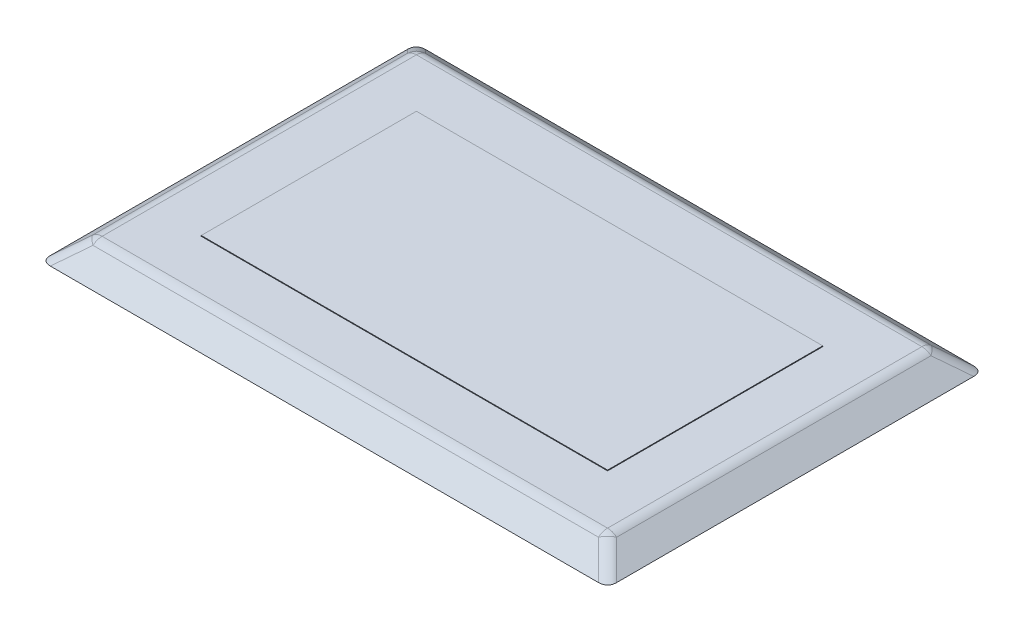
SolidWorks part; units mm, degrees
ref_plane "Front Plane" through (0, 0, 0) normal (0, 0, 1) x (1, 0, 0)
ref_plane "Top Plane" through (0, 0, 0) normal (0, 1, 0) x (1, 0, 0)
ref_plane "Right Plane" through (0, 0, 0) normal (1, 0, 0) x (0, 0, -1)
sketch "Sketch1" plane through (0, 0, 0) normal (0, 1, 0) x (1, 0, 0)
  line L1 (-40, 26.5) -> (40, 26.5)
  line L2 (-40, 26.5) -> (-40, -26.5)
  line L3 (-40, -26.5) -> (40, -26.5)
  line L4 (40, 26.5) -> (40, -26.5)
  line L5 (-40, 26.5) -> (40, -26.5) construction
  line L6 (-40, -26.5) -> (40, 26.5) construction
  point P0 (0, 0)
  dimension "D1" = 80
  dimension "D2" = 53
extrude "Boss-Extrude1" add sketch "Sketch1" along normal blind 3
chamfer "Chamfer1" distance 3 angle 50 4 edges at (-40, 3, 0) (0, 3, -26.5) (40, 3, 0) (0, 3, 26.5)
fillet "Fillet1" radius 2 8 edges at (0, 3, 22.9247) (36.4247, 3, 0) (0, 3, -22.9247) (-36.4247, 3, 0) (-38.2124, 1.5, -24.7124) (-38.2124, 1.5, 24.7124) (38.2124, 1.5, -24.7124) (38.2124, 1.5, 24.7124)
sketch "Sketch2" plane through (0, 3, 0) normal (0, 1, 0) x (1, 0, 0)
  line L0 (35.6968, -22.1968) -> (35.6968, 22.1968) construction
  line L1 (-28.6968, 15.1968) -> (28.6968, 15.1968)
  line L2 (-28.6968, 15.1968) -> (-28.6968, -15.1968)
  line L3 (-28.6968, -15.1968) -> (28.6968, -15.1968)
  line L4 (28.6968, 15.1968) -> (28.6968, -15.1968)
  line L5 (-28.6968, 15.1968) -> (28.6968, -15.1968) construction
  line L6 (-28.6968, -15.1968) -> (28.6968, 15.1968) construction
  line L7 (-35.6968, -22.1968) -> (35.6968, -22.1968) construction
  point P0 (0, 0)
  point P6 (35.6968, 0)
  dimension "D1" = 7
  dimension "D2" = 7
extrude "Boss-Extrude2" add sketch "Sketch2" along normal blind 0.1
sketch "Sketch3" plane through (0, 3.1, 0) normal (0, 1, 0) x (1, 0, 0)
  line L0 (-21.997, -5.1235) -> (21.997, -5.1235)
  line L1 (-21.997, -7.189) -> (21.997, -7.189)
  line L2 (-21.997, -7.189) -> (-21.997, -9.1235)
  line L3 (-21.997, -9.1235) -> (21.997, -9.1235)
  line L4 (21.997, -7.189) -> (21.997, -9.1235)
  line L5 (-21.997, -7.189) -> (21.997, -9.1235) construction
  line L6 (-21.997, -9.1235) -> (21.997, -7.189) construction
  line L7 (21.997, -3.189) -> (21.997, -5.1235)
  line L8 (-21.997, -3.189) -> (21.997, -3.189)
  line L9 (-21.997, -3.189) -> (-21.997, -5.1235)
  line L10 (-21.997, -1.1235) -> (21.997, -1.1235)
  line L11 (21.997, 0.811) -> (21.997, -1.1235)
  line L12 (-21.997, 0.811) -> (21.997, 0.811)
  line L13 (-21.997, 0.811) -> (-21.997, -1.1235)
  line L14 (-21.997, 2.8765) -> (21.997, 2.8765)
  line L15 (21.997, 4.811) -> (21.997, 2.8765)
  line L16 (-21.997, 4.811) -> (21.997, 4.811)
  line L17 (-21.997, 4.811) -> (-21.997, 2.8765)
  line L18 (-21.997, 6.8765) -> (21.997, 6.8765)
  line L19 (21.997, 8.811) -> (21.997, 6.8765)
  line L20 (-21.997, 8.811) -> (21.997, 8.811)
  line L21 (-21.997, 8.811) -> (-21.997, 6.8765)
  point P0 (0, -8.1562)
  dimension "D1" = 5
